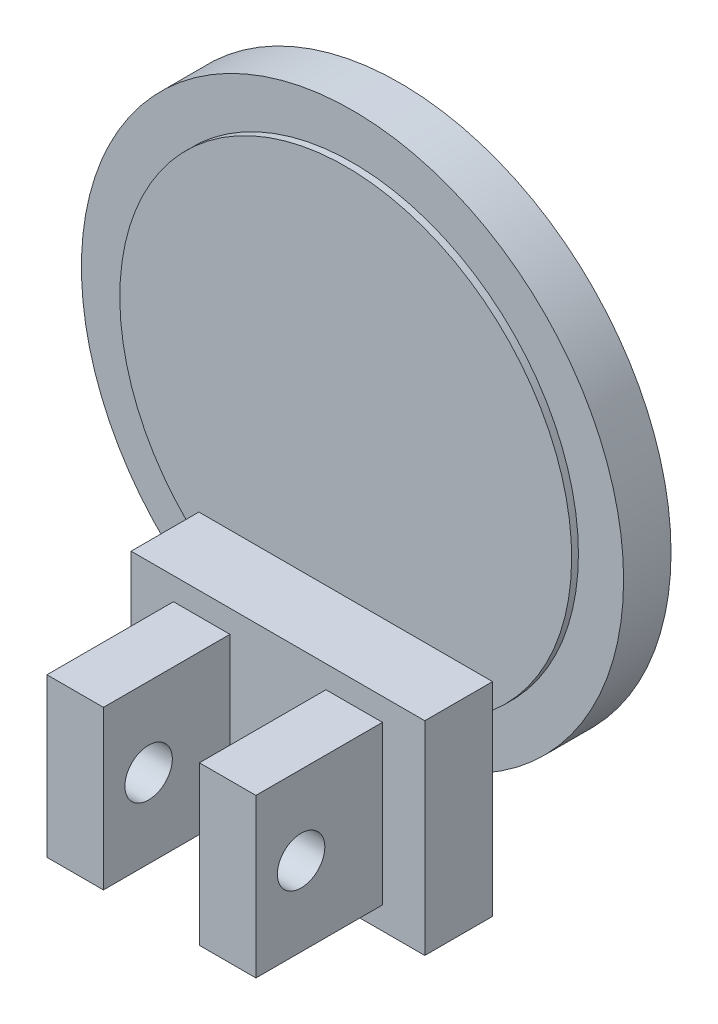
SolidWorks part; units mm, degrees
ref_plane "前视基准面" through (0, 0, 0) normal (0, 0, 1) x (1, 0, 0)
ref_plane "上视基准面" through (0, 0, 0) normal (0, 1, 0) x (1, 0, 0)
ref_plane "右视基准面" through (0, 0, 0) normal (1, 0, 0) x (0, 0, -1)
other "Configuration Table"
sketch "草图1" plane through (0, 0, 0) normal (0, 0, 1) x (1, 0, 0)
  circle A0 centre (0, 0) radius 24
extrude "01_DISC_D48" add sketch "草图1" along normal blind 4.2
ref_plane "Plane_Turntable_Top" through (0, 0, 4.2) normal (0, 0, 1) x (1, 0, 0)
sketch "草图2" plane through (0, 0, 4.2) normal (0, 0, 1) x (1, 0, 0)
  circle A0 centre (0, 0) radius 20
extrude "02_BOSS_D42" add sketch "草图2" along normal blind 0.6
ref_plane "Plane_Cradle_Mid" through (0, -22, 0) normal (0, 1, 0) x (1, 0, 0)
sketch "草图3" plane through (0, -22, 0) normal (0, 1, 0) x (1, 0, 0)
  line L1 (-13, -10.8) -> (13, -10.8)
  line L2 (-13, -10.8) -> (-13, -4.8)
  line L3 (-13, -4.8) -> (13, -4.8)
  line L4 (13, -10.8) -> (13, -4.8)
extrude "03_CRADLE_BASE" add sketch "草图3" against normal mid plane 18
sketch "草图4" plane through (0, -22, 0) normal (0, 1, 0) x (1, 0, 0)
  line L0 (-13, -10.8) -> (13, -10.8) construction
  line L1 (4.25, -22) -> (9.25, -22)
  line L2 (4.25, -22) -> (4.25, -10.8)
  line L3 (4.25, -10.8) -> (9.25, -10.8)
  line L4 (9.25, -22) -> (9.25, -10.8)
extrude "04_EAR_R" add sketch "草图4" against normal mid plane 14
sketch "草图5" plane through (0, -22, 0) normal (0, 1, 0) x (1, 0, 0)
  line L0 (-13, -10.8) -> (13, -10.8) construction
  line L1 (-9.25, -22) -> (-4.25, -22)
  line L2 (-9.25, -22) -> (-9.25, -10.8)
  line L3 (-9.25, -10.8) -> (-4.25, -10.8)
  line L4 (-4.25, -22) -> (-4.25, -10.8)
extrude "04_EAR_L" add sketch "草图5" against normal mid plane 14
sketch "草图6" plane through (0, 0, 0) normal (1, 0, 0) x (0, 0, -1)
  circle A0 centre (-18, -22) radius 2.1
extrude "05_PIN_HOLE_R" cut sketch "草图6" along normal through all
sketch "草图7" plane through (0, 0, 0) normal (1, 0, 0) x (0, 0, -1)
  circle A0 centre (-18, -22) radius 2.1
extrude "05_PIN_HOLE_L" cut sketch "草图7" against normal through all
